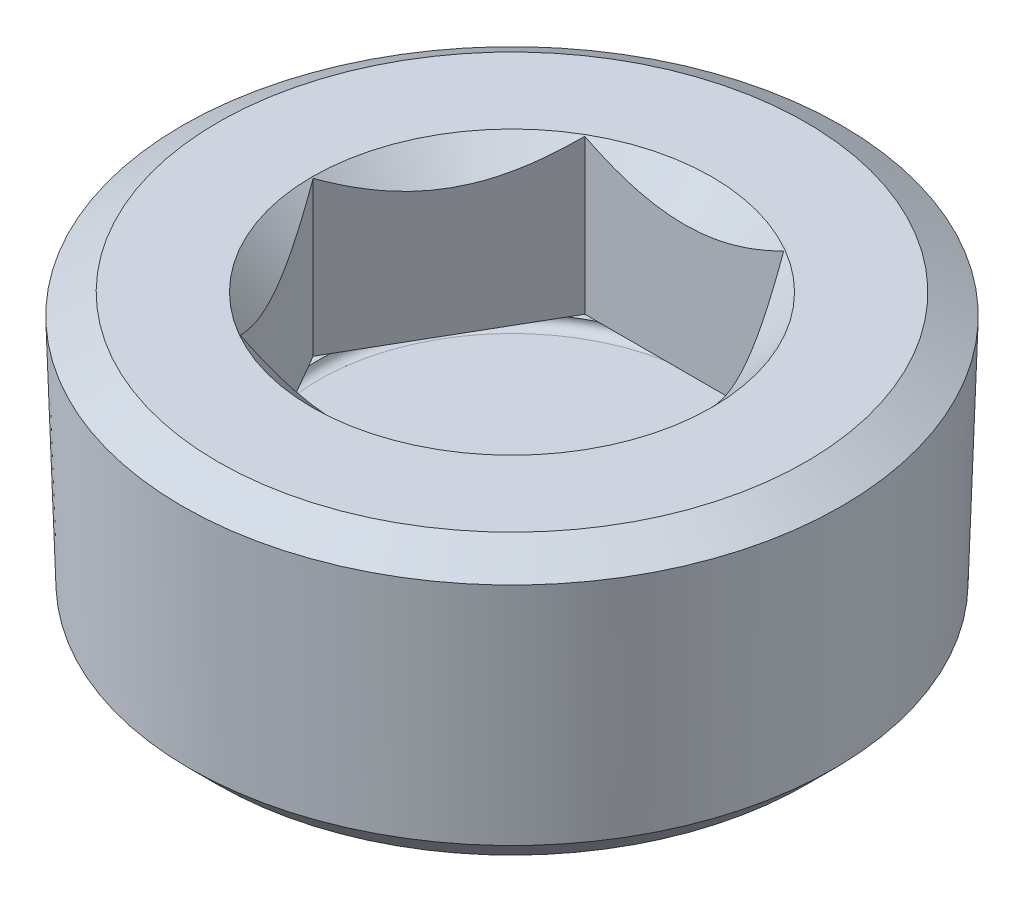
SolidWorks part; units mm, degrees
ref_plane "Front Plane" through (0, 0, 0) normal (0, 0, 1) x (1, 0, 0)
ref_plane "Top Plane" through (0, 0, 0) normal (0, 1, 0) x (1, 0, 0)
ref_plane "Right Plane" through (0, 0, 0) normal (1, 0, 0) x (0, 0, -1)
sketch "Sketch2" plane through (0, 0, 0) normal (0, 0, 1) x (1, 0, 0)
  line L0 (0, 10.7443) -> (0, -17.0657) construction
  line L1 (0, 0) -> (-21.6828, 0)
  line L2 (-24.3112, -1.5175) -> (-23.7802, -18.5273)
  line L3 (-21.6828, -20.6248) -> (0, -20.6248)
  line L4 (0, -20.6248) -> (0, 0)
  line L6 (-21.6828, -20.6248) -> (-23.7802, -18.5273)
  line L7 (-21.6828, 0) -> (-24.3112, -1.5175)
  point P4 (-24.3586, 0)
  point P6 (-23.7148, -20.6248)
  dimension "D1" = 20.6248
  dimension "D2" = 1.788
  dimension "D3" = 48.7172
  dimension "D4" = 30
  dimension "D5" = 2.032
  dimension "D6" = 45
revolve "Revolve1" add sketch "Sketch2" angle 360 about L0
sketch "Sketch3" plane through (0, 0, 0) normal (0, 0, 1) x (1, 0, 0)
  line L0 (0, 2.9342) -> (0, -18.7525) construction
  line L1 (0, 0) -> (-14.732, 0)
  line L2 (21.6828, 0) -> (-21.6828, 0) construction
  line L3 (-12.7, -2.032) -> (-12.7, -11.43)
  line L4 (-14.224, -12.7) -> (0, -12.7)
  line L5 (0, -12.7) -> (0, 0)
  line L6 (-12.7, -2.032) -> (-14.732, 0)
  line L7 (-12.7, -11.43) -> (-14.224, -11.43)
  arc A0 (-14.224, -11.43) -> (-14.224, -12.7) centre (-14.224, -12.065) ccw
  dimension "D1" = 11.43
  dimension "D2" = 12.7
  dimension "D3" = 25.4
  dimension "D4" = 2.032
  dimension "D5" = 45
  dimension "D6" = 1.524
revolve "Cut-Revolve1" cut sketch "Sketch3" angle 360 about L0
sketch "Sketch4" plane through (0, 0, 0) normal (0, 1, 0) x (1, 0, 0)
  line L1 (-7.3323, -12.7) -> (7.3323, -12.7)
  line L2 (7.3323, -12.7) -> (14.6647, 0)
  line L3 (14.6647, 0) -> (7.3323, 12.7)
  line L4 (7.3323, 12.7) -> (-7.3323, 12.7)
  line L5 (-7.3323, 12.7) -> (-14.6647, 0)
  line L6 (-14.6647, 0) -> (-7.3323, -12.7)
  circle A0 centre (0, 0) radius 12.7 construction
  circle A1 centre (0, 0) radius 12.7 construction
extrude "Cut-Extrude1" cut sketch "Sketch4" against normal up to vertex (5.2929 mm away)
